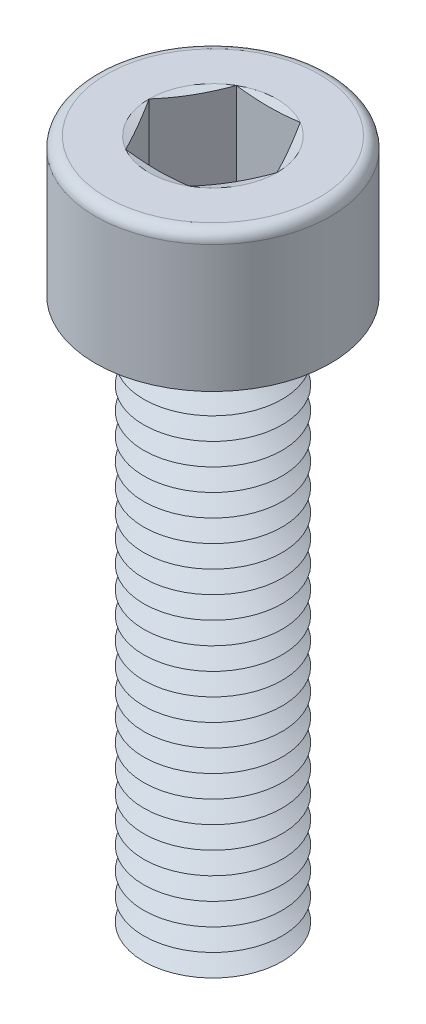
SolidWorks part; units mm, degrees
ref_plane "Front Plane" through (0, 0, 0) normal (0, 0, 1) x (1, 0, 0)
ref_plane "Top Plane" through (0, 0, 0) normal (0, 1, 0) x (1, 0, 0)
ref_plane "Right Plane" through (0, 0, 0) normal (1, 0, 0) x (0, 0, -1)
sketch "Sketch1" plane through (0, 0, 0) normal (0, 1, 0) x (1, 0, 0)
  circle A0 centre (0, 0) radius 2.5
  dimension "D1" = 5
extrude "Extrude1" add sketch "Sketch1" along normal blind 20
sketch "Sketch2" plane through (0, 20, 0) normal (0, 1, 0) x (1, 0, 0)
  circle A0 centre (0, 0) radius 4.25
  dimension "D1" = 8.5
extrude "Extrude2" add sketch "Sketch2" along normal blind 5
sketch "Sketch3" plane through (0, 25, 0) normal (0, 1, 0) x (1, 0, 0)
  line L1 (1.1547, 2) -> (-1.1547, 2)
  line L2 (-1.1547, 2) -> (-2.3094, 0)
  line L3 (-2.3094, 0) -> (-1.1547, -2)
  line L4 (-1.1547, -2) -> (1.1547, -2)
  line L5 (1.1547, -2) -> (2.3094, 0)
  line L6 (2.3094, 0) -> (1.1547, 2)
  circle A0 centre (0, 0) radius 2 construction
  dimension "D1" = 4
extrude "Extrude3" cut sketch "Sketch3" against normal blind 4
fillet "Fillet1" radius 0.4 1 edges at (0, 25, 4.25)
sketch "Sketch4" plane through (0, 0, 0) normal (1, 0, 0) x (0, 0, -1)
  line L0 (-2, 21) -> (0, 21)
  line L1 (0, 21) -> (0, 19.8453)
  line L2 (0, 19.8453) -> (-2, 21)
  dimension "D1" = 30
revolve "Cut-Revolve1" cut sketch "Sketch4" angle 360 about L1
sketch "Sketch5" plane through (0, 0, 0) normal (0, 0, 1) x (1, 0, 0)
  line L0 (-2.5, 0.4) -> (-2.5, -0.4)
  line L1 (-2.5, 20) -> (-2.5, 0) construction
  line L2 (-2.5, -0.4) -> (-1.8072, 0)
  line L3 (-2.5, 0) -> (2.5, 0) construction
  line L4 (-1.8072, 0) -> (-2.5, 0.4)
  dimension "D1" = 0.8
revolve "Cut-Revolve2" cut sketch "Sketch5" angle 360 about axis through (0, 20, 0) along (0, -1, 0)
pattern_linear "LPattern1" count 25 spacing 0.8 along (0, 1, 0) of "Cut-Revolve2"
sketch "Sketch6" plane through (0, 25, 0) normal (0, 1, 0) x (1, 0, 0)
  circle A0 centre (0, 0) radius 2.3094
extrude "Extrude4" cut sketch "Sketch6" against normal through all draft 75
